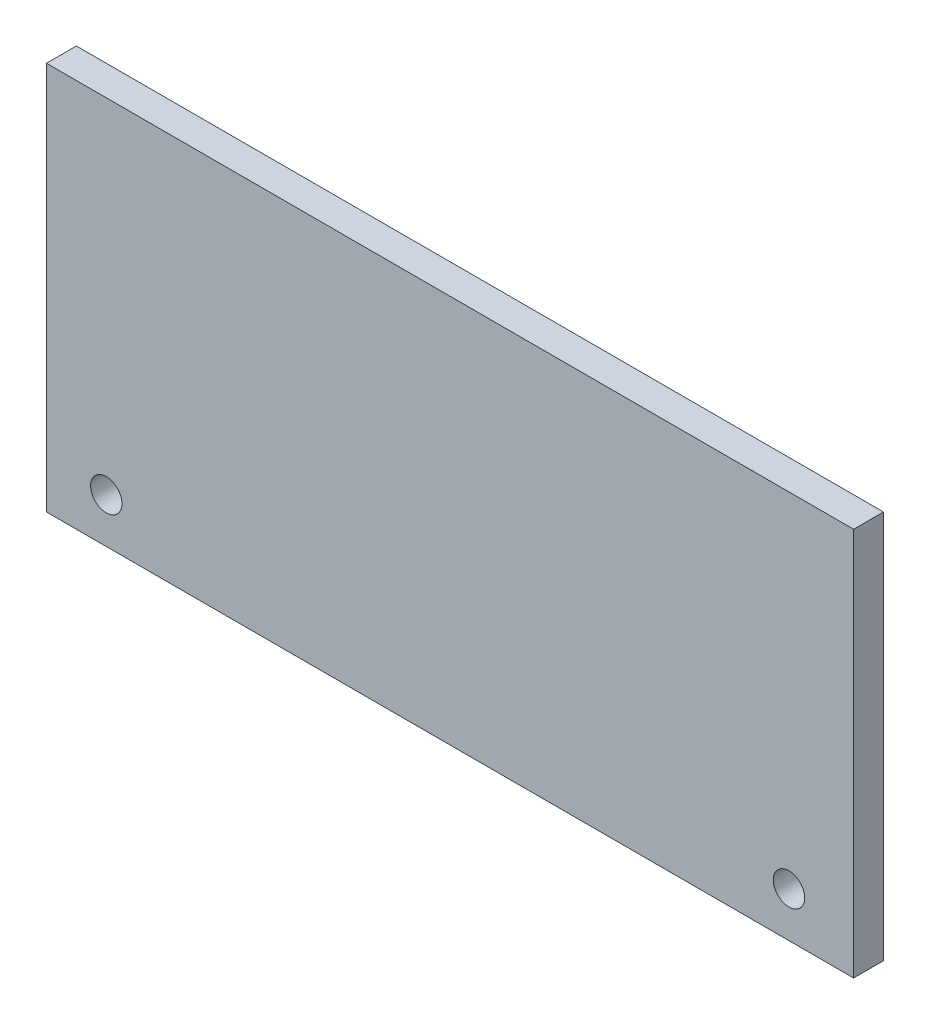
SolidWorks part; units mm, degrees
ref_plane "Plan de face" through (0, 0, 0) normal (0, 0, 1) x (1, 0, 0)
ref_plane "Plan de dessus" through (0, 0, 0) normal (0, 1, 0) x (1, 0, 0)
ref_plane "Plan de droite" through (0, 0, 0) normal (1, 0, 0) x (0, 0, -1)
sketch "Esquisse1" plane through (0, 0, 0) normal (0, 0, 1) x (1, 0, 0)
  line L1 (0, 0) -> (270, 0)
  line L2 (0, 0) -> (0, 130)
  line L3 (0, 130) -> (270, 130)
  line L4 (270, 0) -> (270, 130)
  dimension "D1" = 270
  dimension "D2" = 130
extrude "Extrusion1" add sketch "Esquisse1" against normal blind 10
sketch "Esquisse2" plane through (0, 0, 0) normal (0, 0, 1) x (1, 0, 0)
  line L0 (0, 130) -> (0, 0) construction
  line L1 (0, 0) -> (270, 0) construction
  line L2 (134.188, 121.2291) -> (134.188, 143.1524) construction
  line L3 (134.188, 143.1524) -> (134.188, -22.49) construction
  circle A0 centre (20, 15) radius 5.25
  circle A1 centre (248.3761, 15) radius 5.25
  dimension "D1" = 10.5
  dimension "D2" = 20
  dimension "D3" = 15
extrude "Enlèv. mat.-Extru.1" cut sketch "Esquisse2" against normal blind 10
